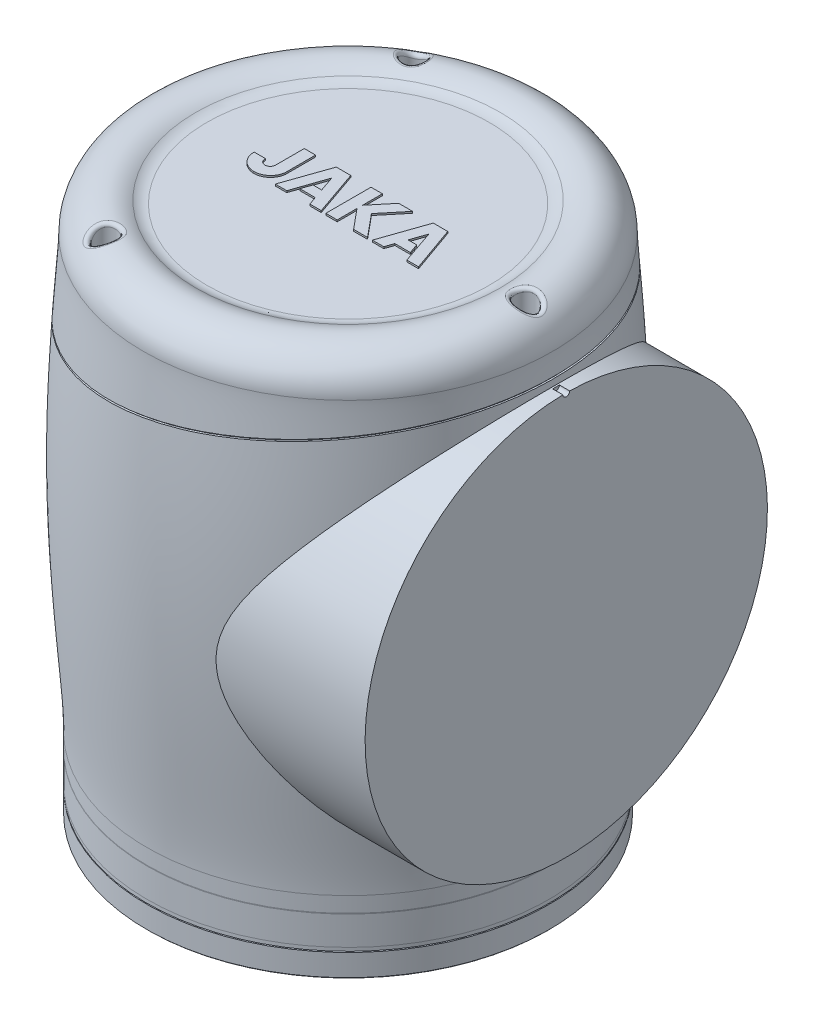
SolidWorks part; units mm, degrees
ref_plane "前视基准面" through (0, 0, 0) normal (0, 0, 1) x (1, 0, 0)
ref_plane "上视基准面" through (0, 0, 0) normal (0, 1, 0) x (1, 0, 0)
ref_plane "右视基准面" through (0, 0, 0) normal (1, 0, 0) x (0, 0, -1)
imported_body "01"
other "删除面1"
sketch "草图1" plane through (64, 0, 0) normal (1, 0, 0) x (0, 0, -1)
  circle A0 centre (0, 139.15) radius 1
  circle A1 centre (0, 80.15) radius 59 construction
  circle A2 centre (0, 80.15) radius 59 construction
  dimension "D1" = 2
extrude "切除-拉伸1" cut sketch "草图1" against normal blind 3
ref_plane "基准面1" through (0, 16.45, 0) normal (0, -1, 0) x (-1, 0, 0)
sketch "草图2" plane through (0, 16.45, 0) normal (0, -1, 0) x (-1, 0, 0)
  circle A0 centre (-59, 0) radius 1
  circle A1 centre (0, 0) radius 59 construction
  dimension "D1" = 2
extrude "切除-拉伸2" cut sketch "草图2" against normal blind 3
